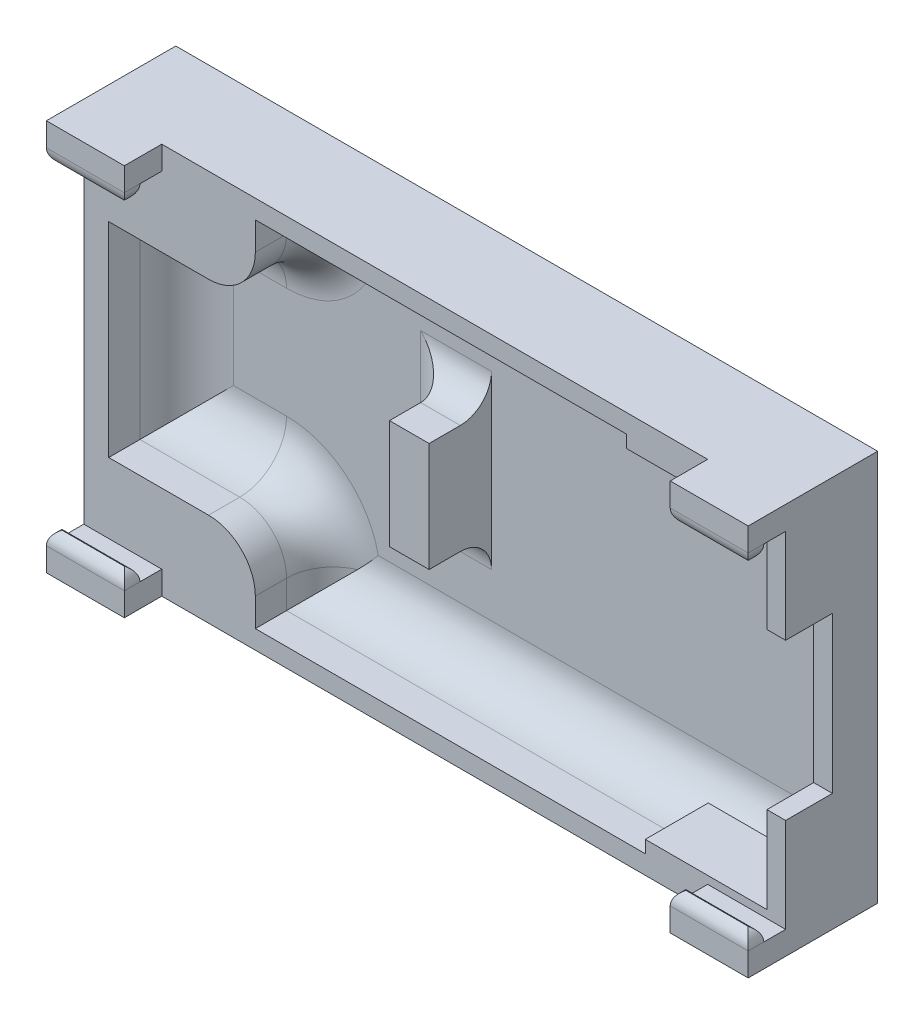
SolidWorks part; units mm, degrees
ref_plane "Bottom Plane" through (0, 0, 0) normal (0, 0, 1) x (1, 0, 0)
ref_plane "Front Plane" through (0, 0, 0) normal (0, 1, 0) x (1, 0, 0)
ref_plane "Left Plane" through (0, 0, 0) normal (1, 0, 0) x (0, 0, -1)
sketch "Sketch1" plane through (0, 0, 0) normal (0, 0, 1) x (1, 0, 0)
  line L0 (-7.6, -11.35) -> (-7.6, -6.55)
  line L1 (-18.6, 12.55) -> (26.4, 12.55)
  line L2 (-18.6, 12.55) -> (-18.6, -12.55)
  line L3 (-18.6, -12.55) -> (26.4, -12.55)
  line L4 (26.4, 12.55) -> (26.4, -12.55)
  line L5 (-7.6, -11.35) -> (17.4, -11.35)
  line L6 (-17, -6.55) -> (-17, 6.55)
  line L7 (-7.6, 11.35) -> (16.2, 11.35)
  line L8 (25.2, -10.55) -> (25.2, -5)
  line L9 (-7.6, -6.55) -> (-17, -6.55)
  line L10 (25.2, 5) -> (25.2, 10.55)
  line L11 (25.2, -5) -> (25.2, 5)
  line L12 (-17, -11.35) -> (-17, -6.55) construction
  line L13 (-17, -11.35) -> (-7.6, -11.35) construction
  line L14 (-7.6, -12.55) -> (-7.6, -11.35) construction
  line L15 (-17, -6.55) -> (-18.6, -6.55) construction
  line L16 (-7.6, 11.35) -> (-7.6, 6.55)
  line L17 (-7.6, 6.55) -> (-17, 6.55)
  line L18 (-17, 6.55) -> (-13.6, 6.55) construction
  line L19 (-17, 11.35) -> (-7.6, 11.35) construction
  line L20 (-17, 6.55) -> (-17, 11.35) construction
  line L21 (-7.6, 12.55) -> (-7.6, 11.35) construction
  line L22 (17.4, -11.35) -> (17.4, -10.55)
  line L23 (17.4, -10.55) -> (25.2, -10.55)
  line L24 (17.4, -11.35) -> (25.2, -11.35) construction
  line L25 (25.2, -11.35) -> (25.2, -10.55) construction
  line L26 (16.2, 11.35) -> (16.2, 10.55)
  line L27 (16.2, 10.55) -> (25.2, 10.55)
  line L28 (16.2, 11.35) -> (25.2, 11.35) construction
  line L29 (25.2, 10.55) -> (25.2, 11.35) construction
  dimension "D1" = 1.2
  dimension "D2" = 1.2
  dimension "D3" = 1.2
  dimension "D4" = 1.6
  dimension "D5" = 6
  dimension "D6" = 11
  dimension "D7" = 6
  dimension "D8" = 26.4
  dimension "D9" = 25.1
  dimension "D10" = 2
  dimension "D11" = 9
  dimension "D12" = 2
  dimension "D13" = 9
  dimension "D14" = 18.6
  dimension "D16" = 12.55
extrude "Boss-Extrude1" add sketch "Sketch1" against normal blind 5
sketch "Sketch2" plane through (26.4, 0, 0) normal (1, 0, 0) x (0, 0, -1)
  line L0 (0, 12.55) -> (0, -12.55) construction
  line L1 (0, 5) -> (3, 5)
  line L2 (0, 5) -> (0, -5)
  line L3 (0, -5) -> (3, -5)
  line L4 (3, 5) -> (3, -5)
  line L5 (5, -12.55) -> (0, -12.55) construction
  line L7 (5, 12.55) -> (0, 12.55) construction
  dimension "D1" = 7.55
  dimension "D2" = 7.55
  dimension "D3" = 3
extrude "Cut-Extrude1" cut sketch "Sketch2" against normal up to next
sketch "Sketch3" plane through (0, 0, -5) normal (0, 0, -1) x (-1, 0, 0)
  line L1 (18.6, 12.55) -> (-26.4, 12.55)
  line L2 (18.6, 12.55) -> (18.6, -12.55)
  line L3 (18.6, -12.55) -> (-26.4, -12.55)
  line L4 (-26.4, 12.55) -> (-26.4, -12.55)
extrude "Boss-Extrude2" add sketch "Sketch3" along normal blind 0.9
sketch "Sketch6" plane through (0, 0, 0) normal (0, 0, 1) x (1, 0, 0)
  line L1 (26.4, 12.55) -> (21.4, 12.55)
  line L2 (26.4, 12.55) -> (26.4, 11.05)
  line L3 (26.4, 11.05) -> (21.4, 11.05)
  line L4 (21.4, 12.55) -> (21.4, 11.05)
  line L5 (-18.6, 12.55) -> (-13.6, 12.55)
  line L6 (-18.6, 12.55) -> (-18.6, 11.05)
  line L7 (-18.6, 11.05) -> (-13.6, 11.05)
  line L8 (-13.6, 12.55) -> (-13.6, 11.05)
  line L9 (-18.6, -12.55) -> (-13.6, -12.55)
  line L10 (-18.6, -12.55) -> (-18.6, -11.05)
  line L11 (-18.6, -11.05) -> (-13.6, -11.05)
  line L12 (-13.6, -12.55) -> (-13.6, -11.05)
  line L13 (26.4, -12.55) -> (21.4, -12.55)
  line L14 (26.4, -12.55) -> (26.4, -11.05)
  line L15 (26.4, -11.05) -> (21.4, -11.05)
  line L16 (21.4, -12.55) -> (21.4, -11.05)
  dimension "D1" = 1.5
  dimension "D2" = 5
  dimension "D3" = 5
  dimension "D4" = 1.5
  dimension "D5" = 5
  dimension "D6" = 1.5
  dimension "D7" = 1.5
  dimension "D8" = 5
extrude "Boss-Extrude3" add sketch "Sketch6" along normal blind 2.4
sketch "Sketch7" plane through (0, 11.05, 0) normal (0, -1, 0) x (1, 0, 0)
  line L1 (26.4, 2.4) -> (21.4, 2.4)
  line L2 (26.4, 2.4) -> (26.4, 1.4)
  line L3 (26.4, 1.4) -> (21.4, 1.4)
  line L4 (21.4, 2.4) -> (21.4, 1.4)
  line L6 (-13.6, 2.4) -> (-18.6, 2.4)
  line L7 (-13.6, 2.4) -> (-13.6, 1.4)
  line L8 (-13.6, 1.4) -> (-18.6, 1.4)
  line L9 (-18.6, 2.4) -> (-18.6, 1.4)
  line L10 (21.4, 2.4) -> (21.4, 0) construction
  line L11 (-18.6, 2.4) -> (-18.6, 0) construction
  dimension "D1" = 1
  dimension "D2" = 1
extrude "Boss-Extrude4" add sketch "Sketch7" along normal blind 1
sketch "Sketch8" plane through (0, -11.05, 0) normal (0, 1, 0) x (1, 0, 0)
  line L1 (21.4, -2.4) -> (26.4, -2.4)
  line L2 (21.4, -2.4) -> (21.4, -1.4)
  line L3 (21.4, -1.4) -> (26.4, -1.4)
  line L4 (26.4, -2.4) -> (26.4, -1.4)
  line L6 (-18.6, -2.4) -> (-13.6, -2.4)
  line L7 (-18.6, -2.4) -> (-18.6, -1.4)
  line L8 (-18.6, -1.4) -> (-13.6, -1.4)
  line L9 (-13.6, -2.4) -> (-13.6, -1.4)
  line L12 (-13.6, -2.4) -> (-13.6, 0) construction
  line L13 (26.4, -2.4) -> (26.4, 0) construction
  dimension "D1" = 1
  dimension "D2" = 1
extrude "Boss-Extrude5" add sketch "Sketch8" along normal blind 1
fillet "Fillet1" radius 1 16 edges at (23.9, 10.05, 1.4) (21.4, 10.05, 1.9) (23.9, 10.05, 2.4) (26.4, 10.05, 1.9) (-16.1, 10.05, 1.4) (-18.6, 10.05, 1.9) (-16.1, 10.05, 2.4) (-13.6, 10.05, 1.9) (-16.1, -10.05, 1.4) (-13.6, -10.05, 1.9) (-16.1, -10.05, 2.4) (-18.6, -10.05, 1.9) (23.9, -10.05, 1.4) (26.4, -10.05, 1.9) (23.9, -10.05, 2.4) (21.4, -10.05, 1.9)
fillet "Fillet2" radius 3 9 edges at (-17, 0, -5) (-7.6, -6.55, -2.5) (-7.6, 6.55, -2.5) (-7.6, -8.95, -5) (-7.6, 8.95, -5) (4.9, -11.35, -5) (4.3, 11.35, -5) (-12.3, -6.55, -5) (-12.3, 6.55, -5)
sketch "Sketch9" plane through (0, 0, -5) normal (0, 0, 1) x (1, 0, 0)
  line L1 (0, -3.5) -> (2.54, -3.5)
  line L2 (0, -3.5) -> (0, 3.5)
  line L3 (0, 3.5) -> (2.54, 3.5)
  line L4 (2.54, -3.5) -> (2.54, 3.5)
  point P4 (0, 0)
  dimension "D1" = 7
  dimension "D2" = 2.54
extrude "Boss-Extrude6" add sketch "Sketch9" along normal blind 4
fillet "Fillet3" radius 2 3 edges at (1.27, 3.5, -5) (1.27, -3.5, -5) (0, 0, -5)
